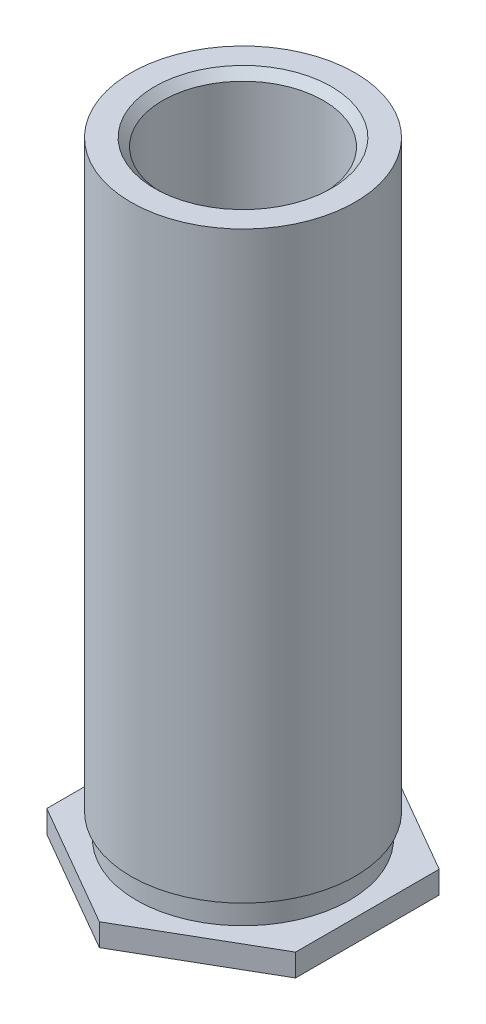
SolidWorks part; units mm, degrees
ref_plane "Plane1" through (0, 0, 0) normal (0, 0, 1) x (1, 0, 0)
ref_plane "Plane2" through (0, 0, 0) normal (0, 1, 0) x (1, 0, 0)
ref_plane "Plane3" through (0, 0, 0) normal (1, 0, 0) x (0, 0, -1)
sketch "BodySke" plane through (0, 0, 0) normal (0, 0, 1) x (1, 0, 0)
  line L0 (3.56, 0) -> (4.582, 0)
  line L1 (4.582, 0) -> (4.582, 0.712)
  line L2 (4.582, 0.712) -> (3.382, 0.712)
  line L3 (2.55, 19.745) -> (2.55, 0.2601)
  line L4 (3.56, 1.4596) -> (3.382, 1.4596)
  line L5 (3.382, 1.4596) -> (3.382, 0.712)
  line L6 (3.56, 0.0051) -> (3.56, 0)
  line L7 (2.805, 0.0051) -> (3.56, 0.0051)
  line L8 (3.56, 20) -> (2.805, 20)
  line L9 (0, 0) -> (0, 15.24) construction
  line L10 (2.805, 20) -> (2.55, 19.745)
  line L11 (3.56, 20) -> (3.56, 1.4596)
  line L12 (2.55, 0.2601) -> (2.805, 0.0051)
  dimension "D1" = 0.0051
  dimension "E_dia" = 9.164
  dimension "D2" = 45
  dimension "C_dia" = 7.12
  dimension "D3" = 45
  dimension "Clinching_ht" = 0.712
  dimension "Length" = 20
  dimension "Groove_wid" = 0.7476
  dimension "Groove_dia" = 6.764
  dimension "Thru_dia" = 5.1
  dimension "Chamfer_dia" = 5.61
revolve "Body" add sketch "BodySke" angle 360 about L9
ref_plane "Plane4" through (0, -0.5486, 0) normal (0, 1, 0) x (-1, 0, 0)
sketch "HexDieSke" plane through (0, 0.712, 0) normal (0, 1, 0) x (-1, 0, 0)
  line L0 (0, 4.5611) -> (3.95, 2.2805)
  line L1 (3.95, 2.2805) -> (3.95, -2.2805)
  line L2 (3.95, -2.2805) -> (0, -4.5611)
  line L3 (0, -4.5611) -> (-3.95, -2.2805)
  line L4 (-3.95, -2.2805) -> (-3.95, 2.2805)
  line L5 (-3.95, 2.2805) -> (0, 4.5611)
  circle A1 centre (0, 0) radius 3.95 construction
  circle A2 centre (0, 0) radius 4.5611 construction
  circle A3 centre (0, 0) radius 4.5825
  dimension "Width_across_flats" = 7.9
  dimension "OD" = 9.165
extrude "HexDie" cut sketch "HexDieSke" against normal blind 0.712
equation "' \"Length@BodySke\" = 20"
equation "' \"Thru_dia@BodySke\" = 5.1"
equation "' \"C_dia@BodySke\" = 7.12"
equation "' \"Width_across_flats@HexDieSke\" = 7.9"
equation "\"E_dia@BodySke\" = \"Width_across_flats@HexDieSke\" * 1.16"
equation "\"Chamfer_dia@BodySke\" = \"Thru_dia@BodySke\" * 1.1"
equation "\"Clinching_ht@BodySke\" = \"C_dia@BodySke\" * 0.1"
equation "\"Groove_dia@BodySke\" = \"C_dia@BodySke\" * 0.95"
equation "\"Groove_wid@BodySke\" = \"Clinching_ht@BodySke\" * 1.05"
equation "\"Depth@HexDie\" = \"Clinching_ht@BodySke\""
equation "\"OD@HexDieSke\" =  \"Width_across_flats@HexDieSke\" * 1.16 + 0.001"
